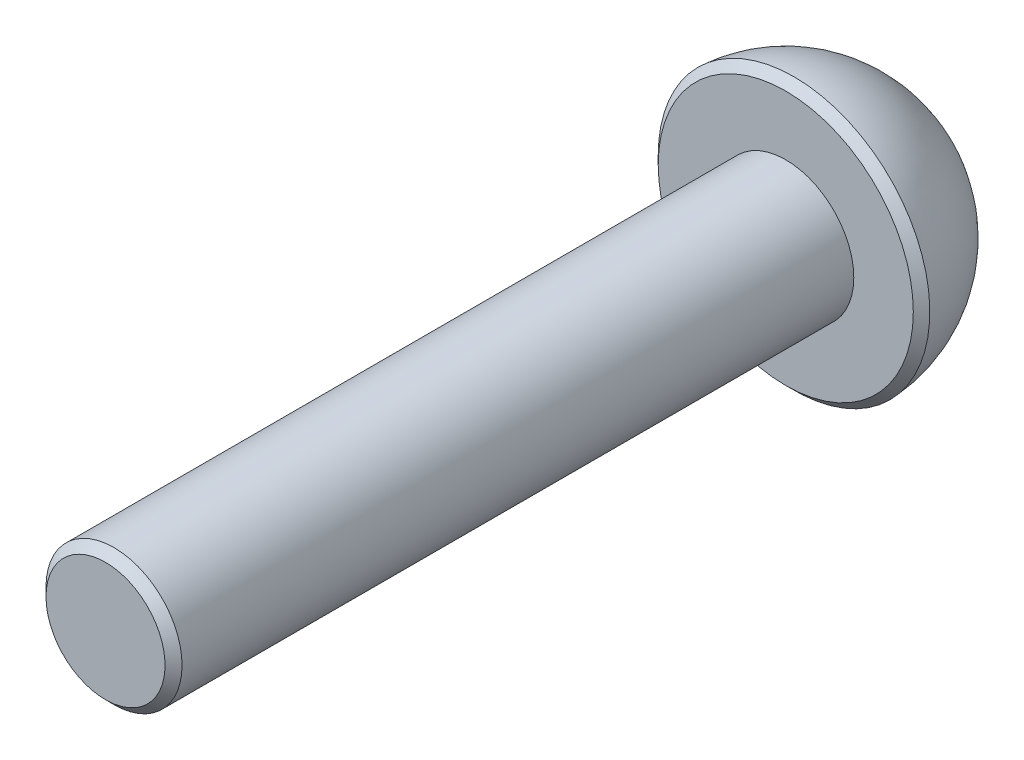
SolidWorks part; units mm, degrees
ref_plane "Спереди" through (0, 0, 0) normal (0, 0, 1) x (1, 0, 0)
ref_plane "Сверху" through (0, 0, 0) normal (0, 1, 0) x (1, 0, 0)
ref_plane "Справа" through (0, 0, 0) normal (1, 0, 0) x (0, 0, -1)
sketch "Эскиз1" plane through (0, 0, 0) normal (1, 0, 0) x (0, 0, -1)
  line L0 (0, 0) -> (24, 0)
  line L1 (0, 0) -> (0, 2)
  line L2 (0, 2) -> (20, 2)
  line L3 (20, 2) -> (20, 4)
  arc A0 (24, 0) -> (20, 4) centre (20, 0) ccw
  dimension "D3" = 8
  dimension "D1" = 2
  dimension "D2" = 20
revolve "Повернуть1" add sketch "Эскиз1" angle 360 about L0
chamfer "Фаска1" distance 0.25 angle 45 2 edges at (4, 0, -20) (2, 0, 0)
